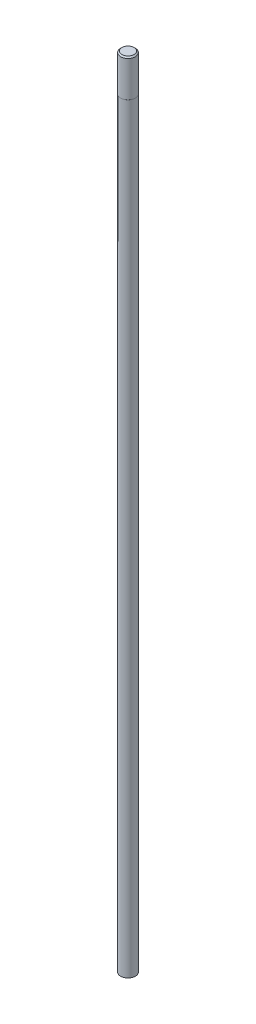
SolidWorks part; units mm, degrees
ref_plane "Front" through (0, 0, 0) normal (0, 0, 1) x (1, 0, 0)
ref_plane "Top" through (0, 0, 0) normal (0, 1, 0) x (1, 0, 0)
ref_plane "Right" through (0, 0, 0) normal (1, 0, 0) x (0, 0, -1)
sketch "Sketch1" plane through (0, 0, 0) normal (0, 1, 0) x (1, 0, 0)
  circle A0 centre (0, 0) radius 2
extrude "Extrude1" add sketch "Sketch1" along normal blind 205
sketch "Sketch2" plane through (0, 205, 0) normal (0, 1, 0) x (-1, 0, 0)
  circle A0 centre (0, 0) radius 1.99
extrude "Extrude2" add sketch "Sketch2" along normal blind 10
chamfer "Chamfer1" distance 0.35 angle 45 1 edges at (0, 215, 1.99)
